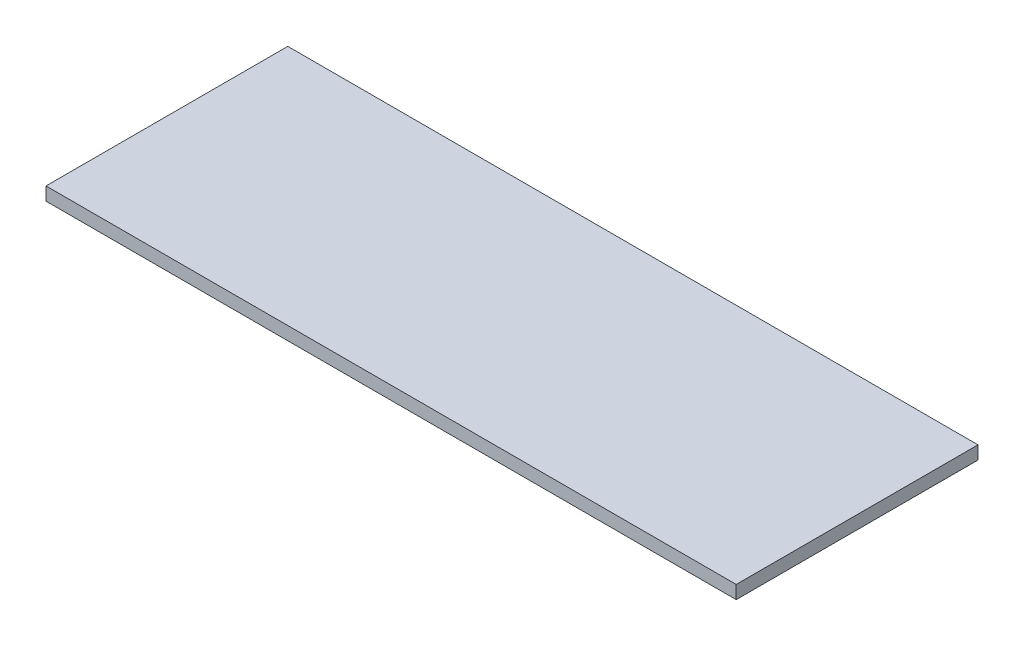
SolidWorks part; units mm, degrees
ref_plane "Front" through (0, 0, 0) normal (0, 0, 1) x (1, 0, 0)
ref_plane "Top" through (0, 0, 0) normal (0, 1, 0) x (1, 0, 0)
ref_plane "Right" through (0, 0, 0) normal (1, 0, 0) x (0, 0, -1)
sketch "Sketch1" plane through (0, 0, 0) normal (0, 1, 0) x (1, 0, 0)
  line L1 (-48.0293, 10.18) -> (31.7267, 10.18)
  line L2 (-48.0293, 10.18) -> (-48.0293, -17.76)
  line L3 (-48.0293, -17.76) -> (31.7267, -17.76)
  line L4 (31.7267, 10.18) -> (31.7267, -17.76)
  dimension "D1" = 79.756
  dimension "D2" = 27.94
extrude "Extrude1" add sketch "Sketch1" along normal blind 1.524
sketch "Sketch2" plane through (0, 1.524, 0) normal (0, 1, 0) x (-1, 0, 0)
  text T0 "Sensor Conditioning Board" font "Century Gothic" height in points 16
